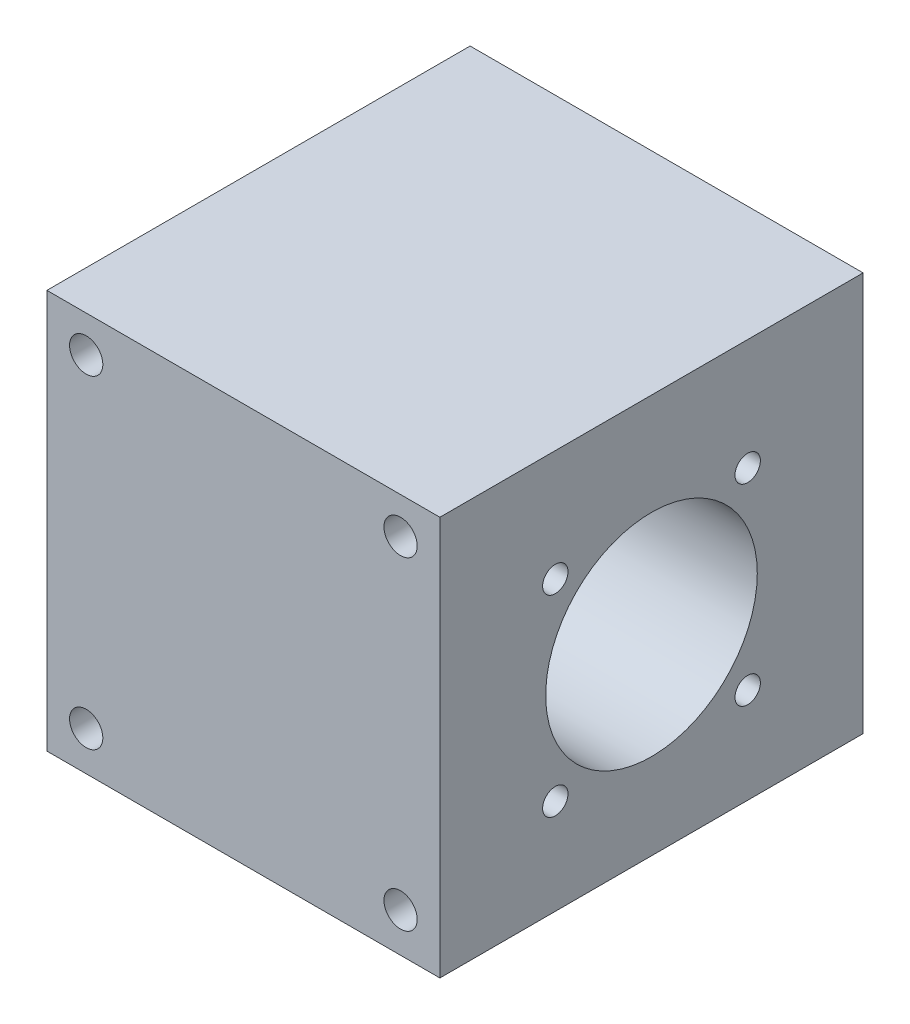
SolidWorks part; units mm, degrees
ref_plane "前视基准面" through (0, 0, 0) normal (0, 0, 1) x (1, 0, 0)
ref_plane "上视基准面" through (0, 0, 0) normal (0, 1, 0) x (1, 0, 0)
ref_plane "右视基准面" through (0, 0, 0) normal (1, 0, 0) x (0, 0, -1)
sketch "草图1" plane through (0, 0, 0) normal (0, 0, 1) x (1, 0, 0)
  line L1 (0, 0) -> (65, 0)
  line L2 (0, 0) -> (0, 66)
  line L3 (0, 66) -> (65, 66)
  line L4 (65, 0) -> (65, 66)
  dimension "D1" = 65
  dimension "D2" = 66
extrude "凸台-拉伸1" add sketch "草图1" along normal blind 70
sketch "草图2" plane through (65, 0, 0) normal (1, 0, 0) x (0, 0, -1)
  line L0 (-35, 0) -> (-35, 66) construction
  line L1 (-70, 0) -> (0, 0) construction
  line L2 (-70, 66) -> (0, 66) construction
  line L3 (-70, 0) -> (0, 0) construction
  circle A0 centre (-35, 31.7) radius 17.5
  dimension "D1" = 35
  dimension "D2" = 31.7
extrude "切除-拉伸1" cut sketch "草图2" against normal through all
hole_wizard "打孔尺寸(%根据)内六角圆柱头螺钉的类型1" positions "草图3" profile "草图4" counterbore size "M5" standard "GB"
sketch "草图3" plane through (0, 0, 0) normal (0, 0, -1) x (-1, 0, 0)
  line L0 (-32.5, 0) -> (-32.5, 66) construction
  line L1 (0, 0) -> (-65, 0) construction
  line L2 (-65, 66) -> (0, 66) construction
  point P0 (-58.5, 6.5)
  point P2 (-6.5, 6.5)
  point P11 (-58.5, 60)
  point P13 (-6.5, 60)
  dimension "D1" = 52
  dimension "D2" = 6.5
  dimension "D3" = 53.5
sketch "草图4" plane through (58.5, 6.5, 0) normal (1, 0, 0) x (0, 1, 0)
  line L0 (0, 0) -> (0, 70)
  line L1 (0, 70) -> (2.75, 70)
  line L3 (2.75, 70) -> (2.75, 40)
  line L4 (2.75, 40) -> (4.75, 40)
  line L5 (4.75, 40) -> (4.75, 0)
  line L7 (4.75, 0) -> (0, 0)
  line L11 (0, -6.35) -> (0, 107.95) construction
  dimension "通孔孔直径" = 5.5
  dimension "通孔孔深度" = 70
  dimension "柱形沉头孔直径" = 9.5
  dimension "柱形沉头孔深度" = 40
hole_wizard "M5 螺纹孔1" positions "草图7" profile "草图8" tap size "M5" standard "GB"
sketch "草图7" plane through (0, 0, 0) normal (-1, 0, 0) x (0, 0, 1)
  line L0 (35, 31.7) -> (99.2102, 31.7) construction
  line L2 (35, 31.7) -> (35, 94.0084) construction
  line L3 (35, 31.7) -> (93.7084, 90.4084) construction
  circle A0 centre (35, 31.7) radius 22.5 construction
  point P0 (19.0901, 47.6099)
  point P2 (50.9099, 47.6099)
  point P4 (50.9099, 15.7901)
  point P6 (19.0901, 15.7901)
  dimension "D1" = 45
  dimension "D2" = 45
sketch "草图8" plane through (0, 47.6099, 19.0901) normal (0, 1, 0) x (0, 0, 1)
  line L0 (0, 0) -> (0, 13.6618)
  line L1 (0, 13.6618) -> (2.1, 12.4)
  line L2 (2.1, 12.4) -> (2.1, 0)
  line L5 (2.1, 0) -> (0, 0)
  line L10 (0, 13.6618) -> (-2.1, 12.4) construction
  line L11 (0, -6.35) -> (0, 107.95) construction
  dimension "螺纹孔钻头直径" = 4.2
  dimension "螺纹孔钻头深度" = 12.4
  dimension "导头角度" = 118
ref_plane "基准面1" through (32.5, 0, 0) normal (-1, 0, 0) x (0, 0, 1)
mirror "镜向1" about plane through (32.5, 0, 0) normal (-1, 0, 0) of "M5 螺纹孔1"
sketch "草图19" plane through (0, 0, 0) normal (0, 0, -1) x (-1, 0, 0)
  line L3 (-40.9745, 39.9998) -> (-38.8991, 36.0637)
  line L4 (-38.8991, 36.0637) -> (-44.2383, 36.0637)
  line L5 (-44.2383, 36.0637) -> (-45.7, 39.1659)
  line L6 (-45.7, 39.1659) -> (-46.8484, 41.6034)
  line L7 (-45.0425, 43.4985) -> (-46.9195, 43.4985)
  line L8 (-49.1038, 36.0637) -> (-54.2426, 36.0637)
  line L9 (-54.2426, 36.0637) -> (-51.4924, 45.4665)
  line L10 (-51.4924, 45.4665) -> (-43.6202, 45.4665)
  line L11 (-20.4992, 48.8094) -> (-22.4845, 46.7308)
  line L12 (-17.5443, 48.8094) -> (-20.4992, 48.8094)
  line L13 (-19.6013, 46.6532) -> (-17.5443, 48.8094)
  line L14 (-22.4597, 46.6532) -> (-19.6013, 46.6532)
  line L15 (-22.4845, 46.7308) -> (-22.4597, 46.6532)
  line L16 (-20.0279, 50.0915) -> (-21.5055, 50.0915)
  line L17 (-21.0565, 49.0133) -> (-20.0279, 50.0915)
  line L18 (-22.534, 49.0133) -> (-21.0565, 49.0133)
  line L19 (-21.5055, 50.0915) -> (-22.534, 49.0133)
  line L20 (-23.1746, 48.593) -> (-24.9126, 48.593)
  line L21 (-24.3844, 47.3247) -> (-23.1746, 48.593)
  line L22 (-26.1225, 47.3247) -> (-24.3844, 47.3247)
  line L23 (-24.9126, 48.593) -> (-26.1225, 47.3247)
  line L24 (-31.083, 42.0487) -> (-28.9157, 39.347)
  line L25 (-28.9157, 39.347) -> (-29.8668, 36.0637)
  line L26 (-29.8668, 36.0637) -> (-35.1332, 36.0637)
  line L27 (-35.1332, 36.0637) -> (-34.0307, 39.94)
  line L28 (-34.0307, 39.94) -> (-38.2325, 45.4665)
  line L29 (-38.2325, 45.4665) -> (-33.8247, 45.4665)
  line L30 (-33.8247, 45.4665) -> (-31.083, 42.0487)
  line L31 (-16.165, 38.7336) -> (-12.6899, 41.1235)
  line L32 (-12.6899, 41.1235) -> (-9.5773, 36.0455)
  line L33 (-9.5773, 36.0455) -> (-14.862, 36.0455)
  line L34 (-14.862, 36.0455) -> (-16.165, 38.7336)
  line L35 (-26.6903, 46.6532) -> (-22.5587, 46.6532)
  line L36 (-22.5587, 46.6532) -> (-28.7797, 39.8164)
  line L37 (-28.7797, 39.8164) -> (-30.8045, 42.3406)
  line L38 (-30.8045, 42.3406) -> (-26.6903, 46.6532)
  line L39 (-20.0971, 36.9065) -> (-20.3469, 36.0455)
  line L40 (-20.3469, 36.0455) -> (-25.3218, 36.0455)
  line L41 (-25.3218, 36.0455) -> (-22.5902, 45.4665)
  line L42 (-22.5902, 45.4665) -> (-17.5972, 45.4665)
  line L43 (-17.5972, 45.4665) -> (-18.8643, 41.1478)
  line L44 (-18.8643, 41.1478) -> (-12.1979, 45.4665)
  line L45 (-12.1979, 45.4665) -> (-7.2468, 45.4665)
  spline S0 degree 3 poles (-46.8484, 41.6034) (-45.8406, 41.6034) (-42.525, 41.392) (-42.5592, 42.6421) knots 0.230769 0.230769 0.230769 0.230769 0.307692 0.307692 0.307692 0.307692
  spline S1 degree 3 poles (-42.5592, 42.6421) (-42.5747, 43.213) (-43.4025, 43.4985) (-45.0425, 43.4985) knots 0.307692 0.307692 0.307692 0.307692 0.384615 0.384615 0.384615 0.384615
  spline S2 degree 3 poles (-46.9195, 43.4985) (-47.6608, 41.0246) (-48.3749, 38.5417) (-49.1038, 36.0637) knots 0.461538 0.461538 0.461538 0.461538 0.538462 0.538462 0.538462 0.538462
  spline S3 degree 3 poles (-43.6202, 45.4665) (-41.4821, 45.4665) (-39.8931, 45.2236) (-38.8534, 44.7377) knots 0.769231 0.769231 0.769231 0.769231 0.846154 0.846154 0.846154 0.846154
  spline S4 degree 3 poles (-37.2593, 42.7514) (-37.2225, 41.4029) (-38.4609, 40.4857) (-40.9745, 39.9998) knots 0.923077 0.923077 0.923077 0.923077 1 1 1 1
  spline S5 degree 3 poles (-38.8534, 44.7377) (-37.8136, 44.2518) (-37.2822, 43.5896) (-37.2593, 42.7514) knots 0.846154 0.846154 0.846154 0.846154 0.923077 0.923077 0.923077 0.923077
  spline S6 degree 3 poles (-7.2468, 45.4665) (-11.6098, 42.8325) (-15.8435, 39.4134) (-20.0971, 36.9065) knots 0.875 0.875 0.875 0.875 1 1 1 1
extrude "切除-拉伸6" cut sketch "草图19" against normal blind 0.2
other "冻结***"
